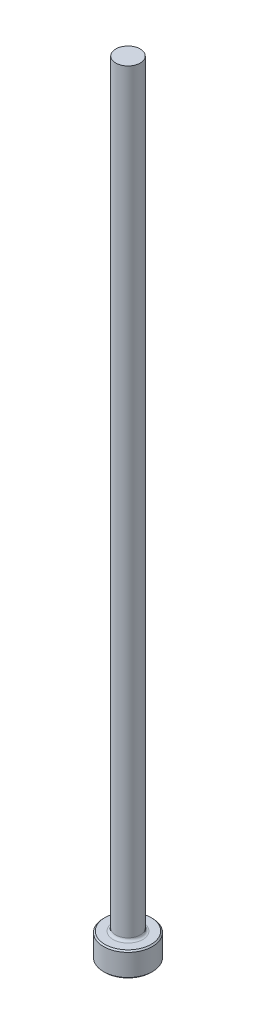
SolidWorks part; units mm, degrees
ref_plane "Front Plane" through (0, 0, 0) normal (0, 0, 1) x (1, 0, 0)
ref_plane "Top Plane" through (0, 0, 0) normal (0, 1, 0) x (1, 0, 0)
ref_plane "Right Plane" through (0, 0, 0) normal (1, 0, 0) x (0, 0, -1)
sketch "Sketch1" plane through (0, 0, 0) normal (0, 0, 1) x (1, 0, 0)
  line L0 (0, 259.9588) -> (0, -15.1925) construction
  line L1 (0, 0) -> (-4.7625, 0)
  line L2 (-4.7625, 0) -> (-4.7625, 4.7498)
  line L3 (-4.7625, 4.7498) -> (-2.3812, 4.7498)
  line L4 (-2.3812, 4.7498) -> (-2.3812, 152.4)
  line L5 (-2.3812, 152.4) -> (0, 152.4)
  line L6 (0, 152.4) -> (0, 0)
  dimension "L" = 152.4
  dimension "H" = 9.525
  dimension "T" = 4.7498
  dimension "D" = 4.7625
revolve "Revolve1" add sketch "Sketch1" angle 360 about L0
chamfer "Chamfer1" distance 0.254 angle 45 2 edges at (0, 4.7498, 4.7625) (0, 0, 4.7625)
fillet "Fillet1" radius 0.508 1 edges at (0, 4.7498, 2.3812)
sketch "Pocket Sketch" plane through (0, 0, 0) normal (0, 0, 1) x (1, 0, 0)
  line L0 (-5.1594, 0) -> (-5.1594, 4.7752)
  line L1 (-5.1594, 4.7752) -> (-3.3417, 4.7752)
  line L2 (-2.5797, 5.5372) -> (-2.5797, 22.225)
  line L3 (-2.5797, 22.225) -> (0, 22.225)
  line L4 (0, 22.225) -> (0, 0)
  line L5 (0, 0) -> (-5.1594, 0)
  line L6 (0, 12.6104) -> (0, -2.4989) construction
  line L7 (-4.7625, 4.4958) -> (-4.7625, 0.254) construction
  line L8 (4.5085, 4.7498) -> (-4.5085, 4.7498) construction
  line L9 (-2.3812, 152.4) -> (-2.3812, 5.2578) construction
  line L10 (-3.3417, 4.7752) -> (-2.5797, 5.5372)
  point P3 (-2.5797, 4.7752)
  dimension "D1" = 10.3187
  dimension "D2" = 0.3969
  dimension "D3" = 0.0254
  dimension "D4" = 0.1984
  dimension "D5" = 5.1594
  dimension "D6" = 22.225
